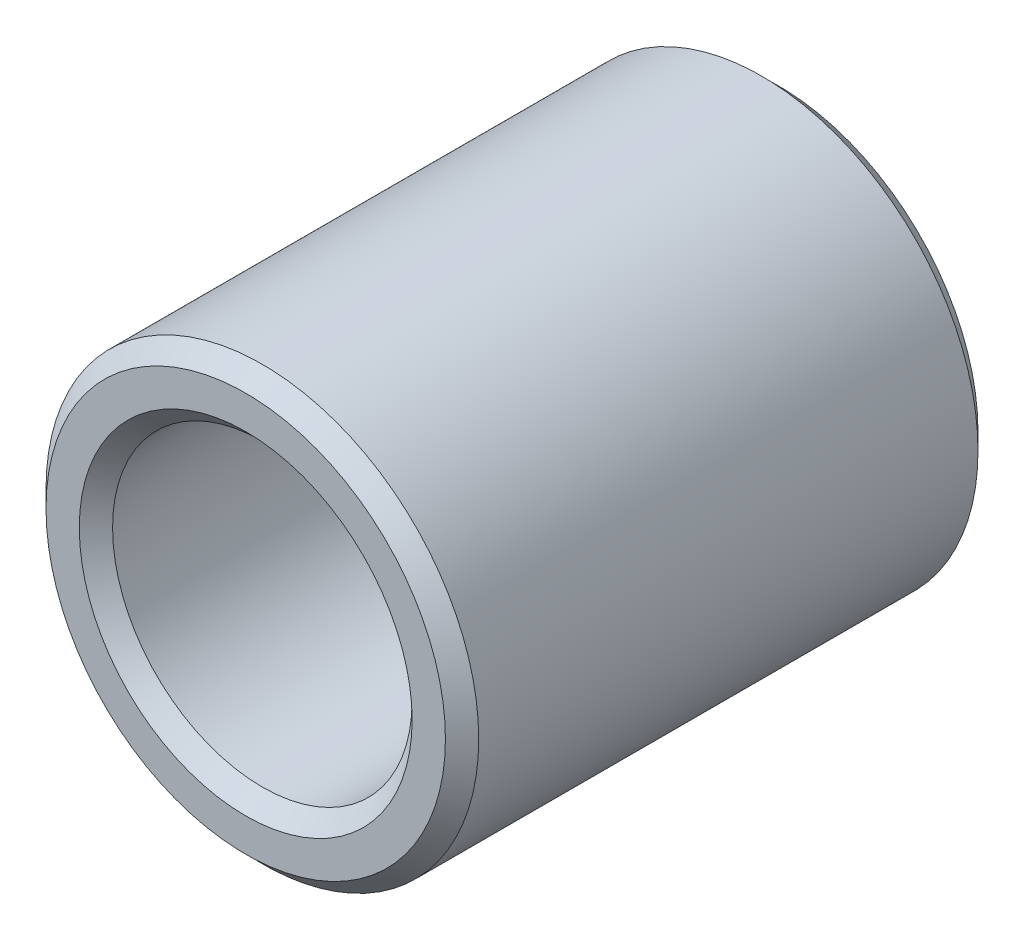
SolidWorks part; units mm, degrees
ref_plane "FACE" through (0, 0, 0) normal (0, 0, 1) x (1, 0, 0)
ref_plane "DESSUS" through (0, 0, 0) normal (0, 1, 0) x (1, 0, 0)
ref_plane "GAUCHE" through (0, 0, 0) normal (1, 0, 0) x (0, 0, -1)
sketch "Esquisse1" plane through (0, 0, 0) normal (0, 0, 1) x (1, 0, 0)
  circle A0 centre (0, 0) radius 4.5
  circle A1 centre (0, 0) radius 6.5
  dimension "D1" = 13
  dimension "D2" = 9
extrude "Base-Extrusion" add sketch "Esquisse1" along normal blind 16
chamfer "Chanfrein1" distance 0.5 angle 45
